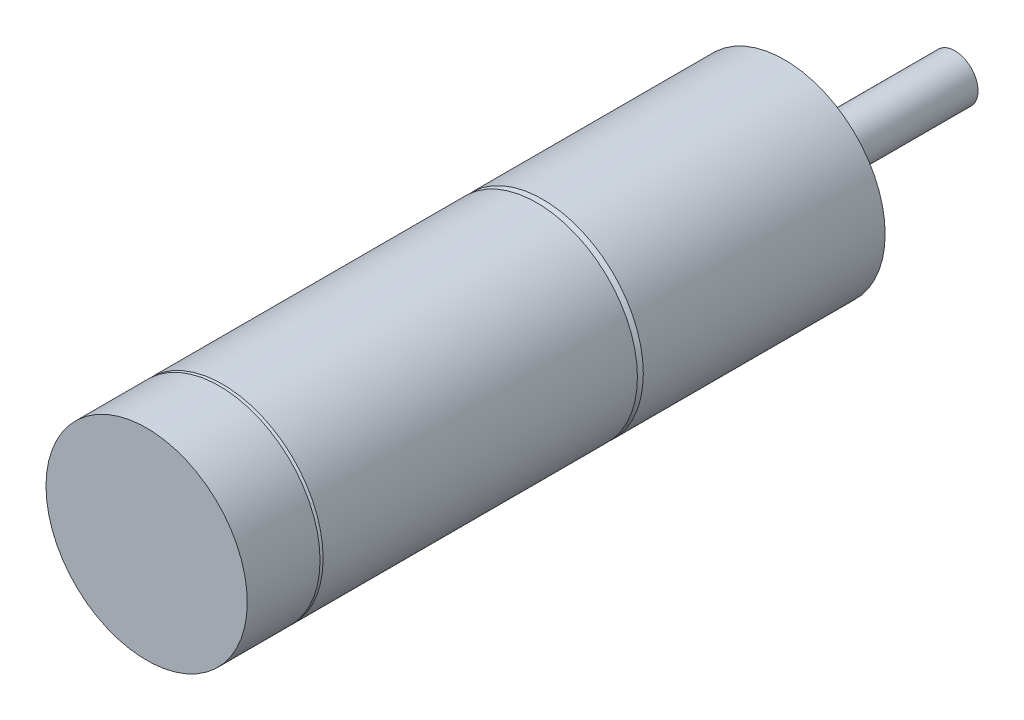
SolidWorks part; units mm, degrees
ref_plane "Front" through (0, 0, 0) normal (0, 0, 1) x (1, 0, 0)
ref_plane "Top" through (0, 0, 0) normal (0, 1, 0) x (1, 0, 0)
ref_plane "Right" through (0, 0, 0) normal (1, 0, 0) x (0, 0, -1)
sketch "Sketch1" plane through (0, 0, 0) normal (0, 0, 1) x (1, 0, 0)
  circle A0 centre (0, 0) radius 6.5
  dimension "D1" = 13
extrude "Extrude1" add sketch "Sketch1" along normal blind 16
chamfer "Chamfer1" distance 0.381 angle 45 1 edges at (6.5, 0, 16)
sketch "Sketch2" plane through (0, 0, 16) normal (0, 0, 1) x (1, 0, 0)
  circle A0 centre (0, 0) radius 6.5
  circle A1 centre (0, 0) radius 6.5 construction
extrude "Extrude2" add sketch "Sketch2" along normal blind 20.5
sketch "Sketch3" plane through (0, 0, 0) normal (0, 0, -1) x (-1, 0, 0)
  circle A0 centre (0, 0) radius 3
  circle A1 centre (0, 0) radius 6.5 construction
  dimension "D1" = 6
extrude "Extrude3" add sketch "Sketch3" along normal blind 1
sketch "Sketch9" plane through (0, 0, -1) normal (0, 0, -1) x (-1, 0, 0)
  circle A1 centre (0, 0) radius 2.5
  dimension "D1" = 5
extrude "Extrude6" add sketch "Sketch9" along normal blind 1.6
sketch "Sketch5" plane through (0, 0, 0) normal (0, 0, -1) x (-1, 0, 0)
  circle A0 centre (0, 0) radius 1.5
  circle A1 centre (0, 0) radius 6.5 construction
  dimension "D1" = 3
extrude "Extrude4" add sketch "Sketch5" along normal blind 11
chamfer "Chamfer2" distance 0.2 angle 45 1 edges at (6.5, 0, 36.5)
sketch "Sketch6" plane through (0, 0, 36.5) normal (0, 0, 1) x (1, 0, 0)
  circle A0 centre (0, 0) radius 6.5
  circle A1 centre (0, 0) radius 6.5 construction
extrude "Extrude5" add sketch "Sketch6" along normal blind 4.7
hole_wizard "M2x0.4 Tapped Hole1" positions "Sketch11" profile "Sketch10" tap size "M2x0.4" standard "Ansi Metric"
sketch "Sketch11" plane through (0, 0, 0) normal (0, 0, -1) x (-1, 0, 0)
  circle A0 centre (0, 0) radius 4.75 construction
  point P0 (3.687, -2.9948)
  dimension "D1" = 9.5
sketch "Sketch10" plane through (-3.687, -2.9948, 0) normal (1, 0, 0) x (0, 1, 0)
  line L0 (0, 0) -> (0, 5.4807)
  line L1 (0, 5.4807) -> (0.8, 5)
  line L2 (0.8, 5) -> (0.8, 4)
  line L3 (0.8, 4) -> (1, 4)
  line L4 (1, 4) -> (1, 0)
  line L5 (1, 0) -> (0, 0)
  line L10 (0, 5.4807) -> (-0.8, 5) construction
  line L11 (0, -6.35) -> (0, 107.95) construction
  dimension "Tap Drill Dia." = 1.6
  dimension "Tap Drill Depth" = 5
  dimension "Thread Major Dia." = 2
  dimension "Thread Depth" = 4
  dimension "Drill Angle" = 118
pattern_circular "CirPattern1" count 2 over 360 about axis through (0, 0, 0) along (0, 0, 1) of "M2x0.4 Tapped Hole1"
